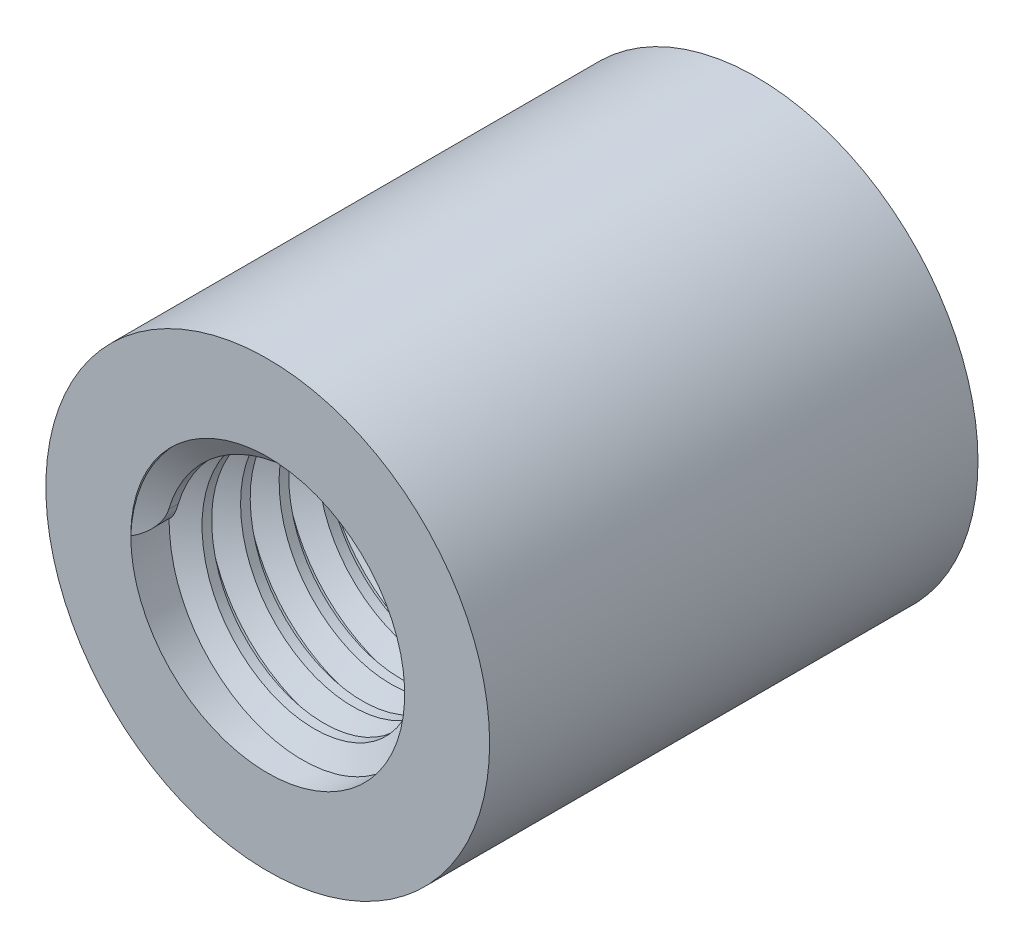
SolidWorks part; units mm, degrees
ref_plane "Ebene vorne" through (0, 0, 0) normal (0, 0, 1) x (1, 0, 0)
ref_plane "Ebene oben" through (0, 0, 0) normal (0, 1, 0) x (1, 0, 0)
ref_plane "Ebene rechts" through (0, 0, 0) normal (1, 0, 0) x (0, 0, -1)
sketch "Skizze1" plane through (0, 0, 0) normal (0, 0, 1) x (1, 0, 0)
  circle A0 centre (0, 0) radius 5.225
  circle A1 centre (0, 0) radius 3.225
  dimension "D1" = 2
  dimension "D2" = 6.45
extrude "Aufsatz-Linear austragen1" add sketch "Skizze1" along normal blind 11.5
thread "Gewinde1" pitch 0.9071 start angle 0, offset 0, length 11.5, pitch 0.9071, diameter 6.45
ref_plane "Ebene1" through (-3.225, 0, 11.5) normal (0, -1, 0) x (-1, 0, 0)
sketch "Gewindeprofil1" plane through (-3.225, 0, 11.5) normal (0, -1, 0) x (-1, 0, 0)
  line L0 (0, 0) -> (0, 0.9071) construction
  line L11 (0, 0) -> (0, 0.7937)
  line L12 (0, 0.7937) -> (-0.491, 0.5103)
  line L13 (-0.491, 0.5103) -> (-0.491, 0.2835)
  line L15 (-0.491, 0.2835) -> (0, 0)
  line L17 (-0.491, 0.3969) -> (0, 0.3969) construction
  point P2 (0, 0)
  dimension "Pitch" = 0.9071
  dimension "Profile_Angle" = 60
  dimension "Profile_Land" = 0.2268
  dimension "Profile_Height" = 0.491
sketch "Skizze7" plane through (0, 0, 0) normal (0, 0, -1) x (-1, 0, 0)
  circle A0 centre (0, 0) radius 3.225 construction
  circle A1 centre (0, 0) radius 3.225
extrude "Schnitt-Linear austragen2" cut sketch "Skizze7" against normal blind 1 and the other way through all
fillet "Verrundung1" radius 1 1 edges at (-2.734, 0, 11.1031)
sketch "Skizze8" plane through (0, 0, 0) normal (1, 0, 0) x (0, 0, -1)
  line L1 (-4.3548, -0.4832) -> (-5.411, -0.4832)
  line L2 (-4.3548, -0.4832) -> (-4.3548, 0.4832)
  line L3 (-4.3548, 0.4832) -> (-5.411, 0.4832)
  line L4 (-5.411, -0.4832) -> (-5.411, 0.4832)
  line L5 (-4.3548, -0.4832) -> (-5.411, 0.4832) construction
  line L6 (-4.3548, 0.4832) -> (-5.411, -0.4832) construction
  point P0 (-4.8829, 0)
wrap "Umwickeln1" [suppressed] sketch "Skizze8" source sketch "Skizze8" thickness 0.2 parameters "D1"=0.2
pattern_circular "Kreismuster1" [suppressed] count 2 every 60
